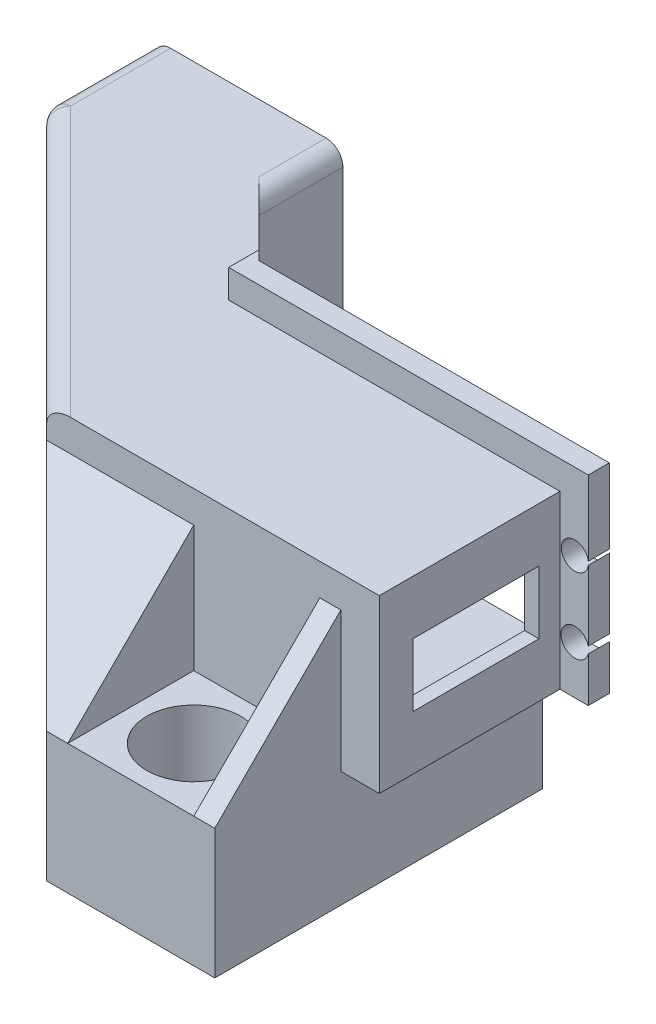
SolidWorks part; units mm, degrees
ref_plane "Front Plane" through (0, 0, 0) normal (0, 0, 1) x (1, 0, 0)
ref_plane "Top Plane" through (0, 0, 0) normal (0, 1, 0) x (1, 0, 0)
ref_plane "Right Plane" through (0, 0, 0) normal (1, 0, 0) x (0, 0, -1)
sketch "Sketch1" plane through (0, 0, 0) normal (0, 0, 1) x (1, 0, 0)
  line L1 (27.178, 17.2339) -> (-27.178, 17.2339)
  line L2 (27.178, 17.2339) -> (27.178, -17.2339)
  line L3 (27.178, -17.2339) -> (-27.178, -17.2339)
  line L4 (-27.178, 17.2339) -> (-27.178, -17.2339)
  line L5 (27.178, 17.2339) -> (-27.178, -17.2339) construction
  line L6 (27.178, -17.2339) -> (-27.178, 17.2339) construction
  line L7 (-27.178, 0) -> (-20.1041, 0) construction
  line L8 (-20.1041, 10.16) -> (-20.1041, -10.16) construction
  line L9 (0, 17.2339) -> (0, 10.16) construction
  line L10 (20.1041, 10.16) -> (-20.1041, 10.16) construction
  line L11 (-27.178, -5.1649) -> (-27.178, 5.1649) construction
  line L13 (20.1041, -10.16) -> (-20.1041, -10.16)
  line L14 (20.1041, -10.16) -> (20.1041, 10.16)
  line L15 (20.1041, 10.16) -> (-20.1041, 10.16)
  line L16 (-20.1041, -10.16) -> (-20.1041, 10.16)
  line L17 (20.1041, -10.16) -> (-20.1041, 10.16) construction
  line L18 (20.1041, 10.16) -> (-20.1041, -10.16) construction
  point P0 (0, 0)
  point P16 (0, 0)
extrude "Boss-Extrude1" add sketch "Sketch1" against normal up to surface (27.94 mm away)
sketch "Sketch2" plane through (0, 0, 0) normal (0, 0, 1) x (1, 0, 0)
  line L0 (20.1041, 10.16) -> (-20.1041, 10.16) construction
  line L1 (22.8981, -12.954) -> (-22.8981, -12.954)
  line L2 (22.8981, -12.954) -> (22.8981, 12.954)
  line L3 (22.8981, 12.954) -> (-22.8981, 12.954)
  line L4 (-22.8981, -12.954) -> (-22.8981, 12.954)
  line L5 (22.8981, -12.954) -> (-22.8981, 12.954) construction
  line L6 (22.8981, 12.954) -> (-22.8981, -12.954) construction
  line L7 (27.178, 17.2339) -> (-27.178, 17.2339)
  line L8 (27.178, 17.2339) -> (27.178, -17.2339)
  line L9 (27.178, -17.2339) -> (-27.178, -17.2339)
  line L10 (-27.178, 17.2339) -> (-27.178, -17.2339)
  line L11 (27.178, 17.2339) -> (-27.178, -17.2339) construction
  line L12 (27.178, -17.2339) -> (-27.178, 17.2339) construction
  line L13 (-20.1041, 10.16) -> (-20.1041, -10.16) construction
  point P0 (0, 0)
  point P6 (0, 0)
  dimension "D1" = 2.794
  dimension "D2" = 2.794
extrude "Cut-Extrude1" cut sketch "Sketch2" against normal offset from surface (24.765 mm away) 3.175
sketch "Sketch3" plane through (0, 0, -27.94) normal (0, 0, -1) x (-1, 0, 0)
  circle A0 centre (-25.146, 5.6769) radius 2.0497
  circle A1 centre (-25.146, -5.6769) radius 2.0955
  circle A2 centre (25.146, -5.6769) radius 2.0955
  circle A3 centre (25.146, 5.6769) radius 2.0955
extrude "Cut-Extrude2" cut sketch "Sketch3" against normal through all
sketch "Sketch4" plane through (22.8981, 0, 0) normal (1, 0, 0) x (0, 0, -1)
  line L0 (0, -12.954) -> (0, 12.954) construction
  line L1 (2.54, 4.7625) -> (21.59, 4.7625)
  line L2 (2.54, 4.7625) -> (2.54, -4.7625)
  line L3 (2.54, -4.7625) -> (21.59, -4.7625)
  line L4 (21.59, 4.7625) -> (21.59, -4.7625)
  point P4 (2.54, 0)
  dimension "D1" = 19.05
  dimension "D2" = 9.525
  dimension "D3" = 2.54
extrude "Cut-Extrude3" cut sketch "Sketch4" against normal up to surface (2.794 mm away)
sketch "Sketch5" plane through (0, 0, 0) normal (0, 0, 1) x (1, 0, 0)
  line L1 (-22.8981, 12.954) -> (22.8981, 12.954)
  line L2 (-22.8981, 12.954) -> (-22.8981, -12.954)
  line L3 (-22.8981, -12.954) -> (22.8981, -12.954)
  line L4 (22.8981, 12.954) -> (22.8981, -12.954)
extrude "Boss-Extrude2" add sketch "Sketch5" along normal blind 2.54
sketch "Sketch6" plane through (0, 0, 2.54) normal (0, 0, 1) x (1, 0, 0)
  line L11 (-22.8981, -12.954) -> (22.8981, -12.954) construction
  line L12 (-8.3185, -12.954) -> (17.0815, -12.954)
  line L13 (-8.3185, -12.954) -> (-8.3185, -17.2339)
  line L14 (-8.3185, -17.2339) -> (17.0815, -17.2339)
  line L15 (17.0815, -12.954) -> (17.0815, -17.2339)
  line L16 (-27.178, -17.2339) -> (27.178, -17.2339) construction
  point P1 (4.3815, -17.2339)
  dimension "D1" = 25.4
  dimension "D2" = 4.3815
extrude "Boss-Extrude3" add sketch "Sketch6" against normal up to surface (27.305 mm away)
sketch "Sketch7" plane through (0, 0, 2.54) normal (0, 0, 1) x (1, 0, 0)
  line L1 (-8.3185, -17.2339) -> (17.0815, -17.2339)
  line L2 (-8.3185, -17.2339) -> (-8.3185, -10.8839)
  line L3 (-8.3185, -10.8839) -> (17.0815, -10.8839)
  line L4 (17.0815, -17.2339) -> (17.0815, -10.8839)
  dimension "D1" = 25.4
  dimension "D2" = 6.35
extrude "Boss-Extrude4" add sketch "Sketch7" along normal blind 19.05
sketch "Sketch8" plane through (0, -10.8839, 0) normal (0, 1, 0) x (1, 0, 0)
  line L0 (17.0815, -21.59) -> (-8.3185, -21.59) construction
  line L1 (-8.3185, -21.59) -> (-8.3185, -2.54) construction
  circle A0 centre (4.3815, -12.065) radius 4.318
  point P4 (4.3815, -21.59)
  point P7 (-8.3185, -12.065)
  dimension "D1" = 8.636
extrude "Cut-Extrude4" cut sketch "Sketch8" against normal blind 19.05
sketch "Sketch9" plane through (0, -10.8839, 0) normal (0, 1, 0) x (1, 0, 0)
  circle A0 centre (4.3815, -12.065) radius 7.112
  dimension "D1" = 14.224
extrude "Cut-Extrude5" cut sketch "Sketch9" against normal blind 1.27
sketch "Sketch10" plane through (0, -10.8839, 0) normal (0, 1, 0) x (1, 0, 0)
  line L0 (22.8981, -2.54) -> (-22.8981, -2.54) construction
  line L1 (17.0815, -21.59) -> (13.9065, -21.59)
  line L2 (17.0815, -21.59) -> (17.0815, -2.54)
  line L3 (17.0815, -2.54) -> (13.9065, -2.54)
  line L4 (13.9065, -21.59) -> (13.9065, -2.54)
  line L6 (-8.3185, -21.59) -> (-5.1435, -21.59)
  line L7 (-8.3185, -21.59) -> (-8.3185, -2.54)
  line L8 (-8.3185, -2.54) -> (-5.1435, -2.54)
  line L9 (-5.1435, -21.59) -> (-5.1435, -2.54)
  dimension "D1" = 3.175
extrude "Boss-Extrude5" add sketch "Sketch10" along normal blind 19.05
chamfer "Chamfer1" distance 19.05 angle 45 2 edges at (-6.731, 8.1661, 21.59) (15.494, 8.1661, 21.59)
sketch "Sketch12" plane through (0, -17.2339, 0) normal (0, -1, 0) x (1, 0, 0)
  line L0 (-8.3185, 21.59) -> (17.0815, 21.59) construction
  line L1 (0.5715, 3.81) -> (8.1915, 3.81)
  line L2 (0.5715, 3.81) -> (0.5715, -27.94)
  line L3 (0.5715, -27.94) -> (8.1915, -27.94)
  line L4 (8.1915, 3.81) -> (8.1915, -27.94)
  line L5 (-27.178, -27.94) -> (27.178, -27.94) construction
  point P8 (4.3815, 3.81)
  point P12 (4.3815, 21.59)
  dimension "D1" = 7.62
  dimension "D2" = 31.75
extrude "Boss-Extrude6" add sketch "Sketch12" along normal blind 3.175
sketch "Sketch13" plane through (0, 0, -27.94) normal (0, 0, -1) x (-1, 0, 0)
  line L1 (20.7391, -10.16) -> (-20.7391, -10.16)
  line L2 (20.7391, -10.16) -> (20.7391, 10.16)
  line L3 (20.7391, 10.16) -> (-20.7391, 10.16)
  line L4 (-20.7391, -10.16) -> (-20.7391, 10.16)
  line L5 (20.7391, -10.16) -> (-20.7391, 10.16) construction
  line L6 (20.7391, 10.16) -> (-20.7391, -10.16) construction
  line L7 (-20.1041, -10.16) -> (-20.1041, 10.16) construction
  line L8 (-20.1041, 10.16) -> (20.1041, 10.16) construction
  point P0 (0, 0)
  dimension "D2" = 0.635
extrude "Cut-Extrude7" cut sketch "Sketch13" against normal offset from surface (27.94 mm away) 2.54
sketch "Sketch14" plane through (0, -20.4089, 0) normal (0, -1, 0) x (1, 0, 0)
  line L1 (0.5715, 3.81) -> (8.1915, 3.81)
  line L2 (0.5715, 3.81) -> (0.5715, -27.94)
  line L3 (0.5715, -27.94) -> (8.1915, -27.94)
  line L4 (8.1915, 3.81) -> (8.1915, -27.94)
extrude "Boss-Extrude7" add sketch "Sketch14" along normal blind 13.2461
sketch "Sketch15" plane through (0, -17.2339, 0) normal (0, -1, 0) x (1, 0, 0)
  line L12 (0.5715, -27.94) -> (0.5715, 3.81)
  line L13 (0.5715, 3.81) -> (8.1915, 3.81)
  line L14 (8.1915, 3.81) -> (8.1915, -27.94)
  line L15 (8.1915, -27.94) -> (27.178, -27.94)
  line L16 (27.178, -27.94) -> (27.178, -24.765)
  line L17 (27.178, -24.765) -> (17.0815, -24.765)
  line L18 (17.0815, -24.765) -> (17.0815, 21.59)
  line L19 (17.0815, 21.59) -> (-8.3185, 21.59)
  line L20 (-8.3185, 21.59) -> (-8.3185, -24.765)
  line L21 (-8.3185, -24.765) -> (-27.178, -24.765)
  line L22 (-27.178, -24.765) -> (-27.178, -27.94)
  line L23 (-27.178, -27.94) -> (0.5715, -27.94)
  line L24 (0.5715, -27.94) -> (0.5715, 3.81)
  line L25 (0.5715, 3.81) -> (8.1915, 3.81)
  line L26 (8.1915, 3.81) -> (8.1915, -27.94)
  line L27 (8.1915, -27.94) -> (27.178, -27.94)
  line L28 (27.178, -27.94) -> (27.178, -24.765)
  line L29 (27.178, -24.765) -> (17.0815, -24.765)
  line L30 (17.0815, -24.765) -> (17.0815, 21.59)
  line L31 (17.0815, 21.59) -> (-8.3185, 21.59)
  line L32 (-8.3185, 21.59) -> (-8.3185, -24.765)
  line L33 (-8.3185, -24.765) -> (-27.178, -24.765)
  line L34 (-27.178, -24.765) -> (-27.178, -27.94)
  line L35 (-27.178, -27.94) -> (0.5715, -27.94)
  circle A0 centre (4.3815, 12.065) radius 4.318
  dimension "D1" = 0
extrude "Boss-Extrude8" add sketch "Sketch15" along normal blind 13.2461
sketch "Sketch16" plane through (0, -12.1539, 0) normal (0, 1, 0) x (1, 0, 0)
  circle A0 centre (4.3815, -12.065) radius 7.112
  dimension "D1" = 14.224
extrude "Cut-Extrude8" cut sketch "Sketch16" against normal blind 10.795
sketch "Sketch17" plane through (0, 0, -24.765) normal (0, 0, 1) x (1, 0, 0)
  line L1 (-27.178, -30.48) -> (-8.3185, -30.48)
  line L2 (-27.178, -30.48) -> (-27.178, -12.954)
  line L3 (-27.178, -12.954) -> (-8.3185, -12.954)
  line L4 (-8.3185, -30.48) -> (-8.3185, -12.954)
  line L5 (27.178, -30.48) -> (17.0815, -30.48)
  line L6 (27.178, -30.48) -> (27.178, -12.954)
  line L7 (27.178, -12.954) -> (17.0815, -12.954)
  line L8 (17.0815, -30.48) -> (17.0815, -12.954)
extrude "Cut-Extrude9" cut sketch "Sketch17" against normal up to surface (3.175 mm away)
sketch "Sketch18" plane through (-22.8981, 0, 0) normal (-1, 0, 0) x (0, 0, 1)
  line L1 (2.54, 12.954) -> (-16.51, 12.954)
  line L2 (2.54, 12.954) -> (2.54, -12.954)
  line L3 (2.54, -12.954) -> (-16.51, -12.954)
  line L4 (-16.51, 12.954) -> (-16.51, -12.954)
  line L5 (-24.765, -12.954) -> (2.54, -12.954) construction
  dimension "D1" = 19.05
extrude "Boss-Extrude9" add sketch "Sketch18" along normal blind 44.1579
sketch "Sketch23" plane through (0, 0, -16.51) normal (0, 0, -1) x (-1, 0, 0)
  line L0 (67.056, -12.954) -> (22.8981, -12.954) construction
  line L1 (67.056, 12.954) -> (38.481, 12.954)
  line L2 (67.056, 12.954) -> (67.056, -12.954)
  line L3 (67.056, -12.954) -> (38.481, -12.954)
  line L4 (38.481, 12.954) -> (38.481, -12.954)
  dimension "D1" = 28.575
extrude "Boss-Extrude11" add sketch "Sketch23" along normal blind 36.83
sketch "Sketch24" plane through (0, 0, -53.34) normal (0, 0, -1) x (-1, 0, 0)
  line L0 (22.8981, 12.954) -> (22.8981, -12.954) construction
  circle A0 centre (52.7685, 0) radius 11
  dimension "D1" = 22
  dimension "D2" = 29.8704
extrude "Cut-Extrude12" cut sketch "Sketch24" against normal blind 8
sketch "Sketch25" plane through (-22.8981, 0, 0) normal (-1, 0, 0) x (0, 0, 1)
  line L1 (-24.765, 12.954) -> (-16.51, 12.954)
  line L2 (-24.765, 12.954) -> (-24.765, -12.954)
  line L3 (-24.765, -12.954) -> (-16.51, -12.954)
  line L4 (-16.51, 12.954) -> (-16.51, -12.954)
extrude "Boss-Extrude12" add sketch "Sketch25" along normal up to surface (15.5829 mm away)
sketch "Sketch26" plane through (-27.178, 0, 0) normal (-1, 0, 0) x (0, 0, 1)
  line L1 (-24.765, -12.954) -> (-27.94, -12.954)
  line L2 (-24.765, -12.954) -> (-24.765, 12.954)
  line L3 (-24.765, 12.954) -> (-27.94, 12.954)
  line L4 (-27.94, -12.954) -> (-27.94, 12.954)
extrude "Boss-Extrude13" add sketch "Sketch26" along normal up to surface (11.303 mm away)
chamfer "Chamfer3" distance 12.7 angle 45 1 edges at (-38.481, 0, -27.94)
chamfer "Chamfer4" distance 38.1 angle 45 1 edges at (-67.056, 0, 2.54)
sketch "Sketch27" plane through (0, -12.954, 0) normal (0, -1, 0) x (1, 0, 0)
  line L0 (-67.056, -35.56) -> (-33.401, -35.56)
  line L8 (-8.3185, 2.54) -> (-28.956, 2.54)
  line L9 (-28.956, 2.54) -> (-67.056, -35.56)
  line L10 (-67.056, -35.56) -> (-67.056, -53.34)
  line L11 (-67.056, -53.34) -> (-38.481, -53.34)
  line L12 (-38.481, -53.34) -> (-38.481, -40.64)
  line L13 (-38.481, -40.64) -> (-25.781, -27.94)
  line L14 (-25.781, -27.94) -> (-8.3185, -27.94)
  line L15 (-8.3185, -27.94) -> (-8.3185, 2.54)
  line L16 (-8.3185, 2.54) -> (-28.956, 2.54)
  line L17 (-28.956, 2.54) -> (-67.056, -35.56)
  line L21 (-33.401, -35.56) -> (-25.781, -27.94)
  line L22 (-25.781, -27.94) -> (-8.3185, -27.94)
  line L23 (-8.3185, -27.94) -> (-8.3185, 2.54)
  dimension "D1" = 0
extrude "Boss-Extrude14" add sketch "Sketch27" along normal up to surface (17.526 mm away)
chamfer "Chamfer5" distance 19.05 angle 45 1 edges at (-8.3185, -11.1569, 2.54)
sketch "Sketch28" plane through (-15.748, 0, 15.748) normal (-0.7071, 0, 0.7071) x (0.7071, 0, 0.7071)
  line L0 (17.9875, 12.954) -> (-18.6789, 12.954) construction
  line L1 (-82.4127, -30.48) -> (-12.8347, -30.48)
  line L2 (-82.4127, -30.48) -> (-82.4127, 12.954)
  line L3 (-82.4127, 12.954) -> (-12.8347, 12.954)
  line L4 (-12.8347, -30.48) -> (-12.8347, 12.954)
extrude "Cut-Extrude13" cut sketch "Sketch28" against normal up to surface (1.1225 mm away)
fillet "Fillet1" radius 2.54 1 edges at (-65.4685, -21.717, -35.56)
fillet "Fillet2" radius 2.54 1 edges at (-67.056, 0, -37.1475)
sketch "Sketch29" plane through (0, 0, -45.34) normal (0, 0, -1) x (-1, 0, 0)
  circle A0 centre (52.7685, 0) radius 3.81
  circle A1 centre (52.7685, 0) radius 11 construction
  dimension "D1" = 7.62
extrude "Cut-Extrude14" cut sketch "Sketch29" against normal blind 6.35
fillet "Fillet3" radius 2.54 8 edges at (-67.056, -12.954, -45.7698) (-38.481, 12.954, -46.99) (-38.481, -12.954, -46.99) (-46.8403, 12.954, -16.9318) (-67.056, 12.954, -45.7698) (-66.8627, 12.954, -37.2276) (-63.7222, -12.954, -33.8138) (-66.8627, -12.954, -37.2276)
fillet "Fillet4" radius 0.635 1 edges at (-63.7685, 0, -53.34)
sketch "Sketch30" plane through (22.8981, 0, 0) normal (1, 0, 0) x (0, 0, -1)
  line L1 (2.54, -4.7625) -> (21.59, -4.7625)
  line L2 (2.54, -4.7625) -> (2.54, 4.7625)
  line L3 (2.54, 4.7625) -> (21.59, 4.7625)
  line L4 (21.59, -4.7625) -> (21.59, 4.7625)
extrude "Cut-Extrude15" cut sketch "Sketch30" against normal through all
sketch "Sketch31" plane through (0, 0, -24.765) normal (0, 0, -1) x (-1, 0, 0)
  circle A0 centre (25.146, 5.6769) radius 2.0955
  circle A1 centre (25.146, -5.6769) radius 2.0955
extrude "Cut-Extrude16" cut sketch "Sketch31" against normal blind 25.4
